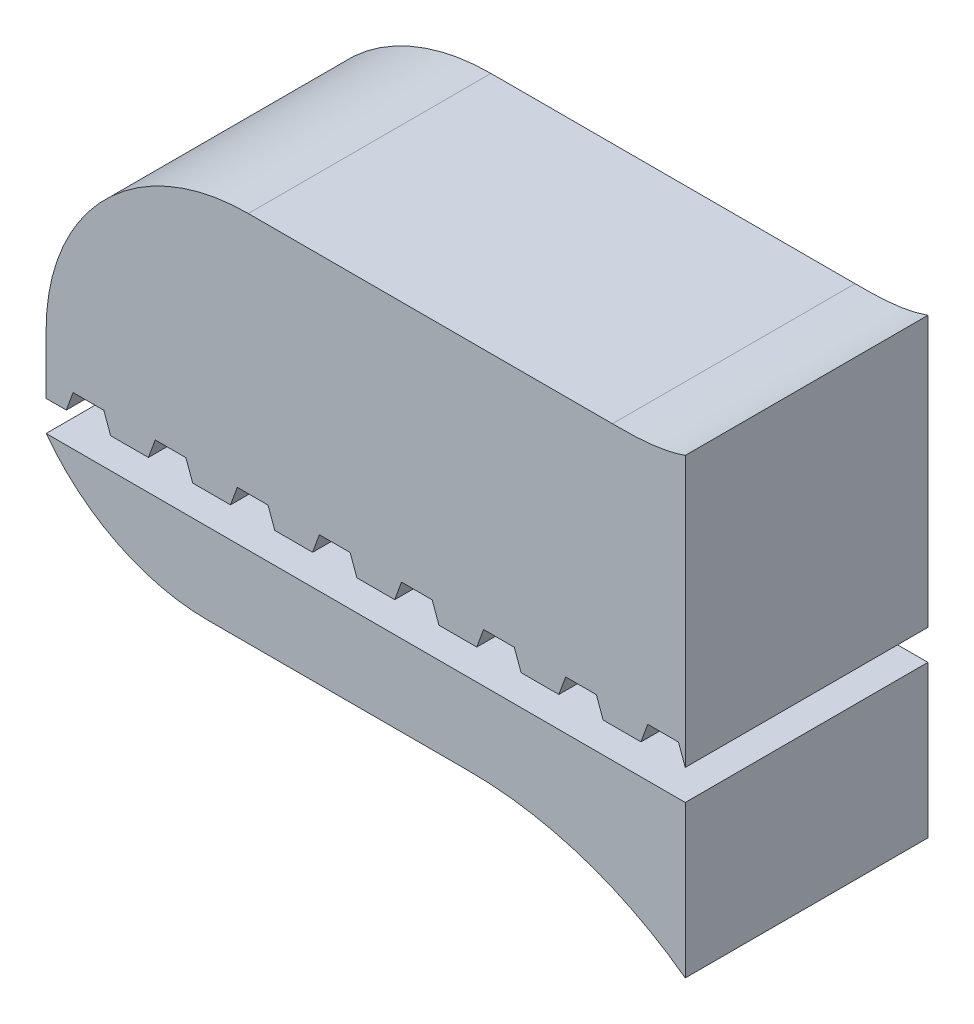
SolidWorks part; units mm, degrees
ref_plane "Front Plane" through (0, 0, 0) normal (0, 0, 1) x (1, 0, 0)
ref_plane "Top Plane" through (0, 0, 0) normal (0, 1, 0) x (1, 0, 0)
ref_plane "Right Plane" through (0, 0, 0) normal (1, 0, 0) x (0, 0, -1)
ref_plane "Front Plane-YankerTensioner_SHARKHEAD_rev1" through (0, 0, 0) normal (0, 0, 1) x (1, 0, 0)
ref_plane "Top Plane-YankerTensioner_SHARKHEAD_rev1" through (0, 0, 0) normal (0, 1, 0) x (1, 0, 0)
ref_plane "Right Plane-YankerTensioner_SHARKHEAD_rev1" through (0, 0, 0) normal (1, 0, 0) x (0, 0, -1)
inserted part "YankerTensioner_SHARKHEAD_rev1"
other "<YankerTensioner_SHARKHEAD_rev1>-<Stock-YankerTensioner-1>"
ref_plane "Plane4" through (-10.4933, 0, 0) normal (-1, 0, 0) x (0, 0, 1)
split "Split1" trim tools "Plane4" bodies to split 101 resulting bodies 102 103 104
delete or keep bodies "Body-Delete1" type delete bodies bodies 104
